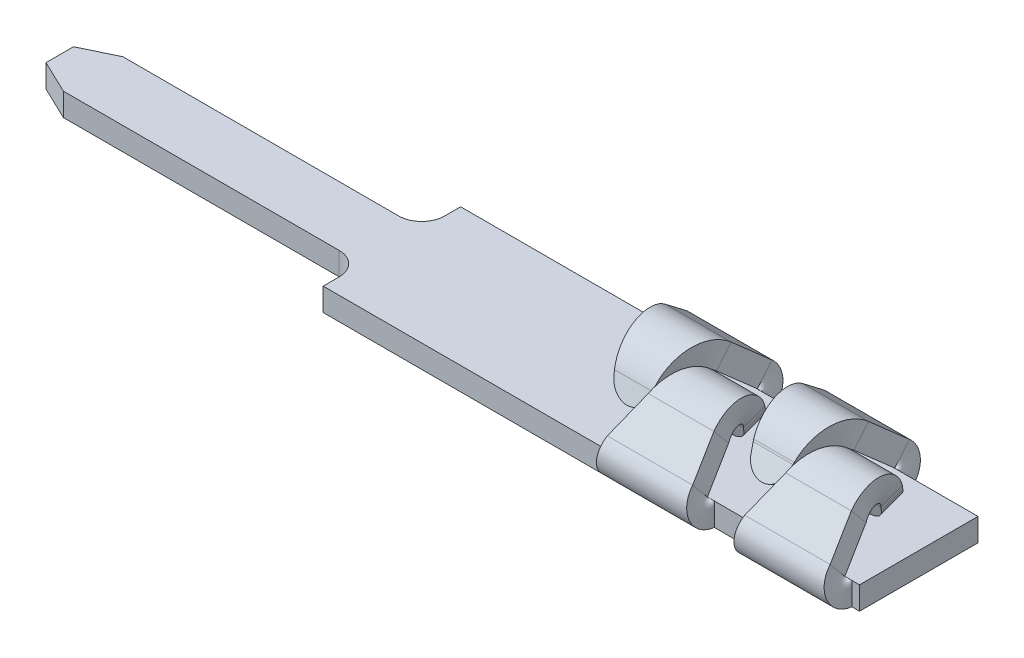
SolidWorks part; units mm, degrees
ref_plane "Front Plane" through (0, 0, 0) normal (0, 0, 1) x (1, 0, 0)
ref_plane "Top Plane" through (0, 0, 0) normal (0, 1, 0) x (1, 0, 0)
ref_plane "Right Plane" through (0, 0, 0) normal (1, 0, 0) x (0, 0, -1)
sketch "Sketch1" plane through (0, 0, 0) normal (0, 1, 0) x (1, 0, 0)
  line L0 (-0.5492, 0.657) -> (-0.5992, 0.657)
  line L1 (-2.921, 0.762) -> (-0.5992, 0.762)
  line L2 (-2.921, 0.762) -> (-2.921, 0.5842)
  line L3 (-2.921, -0.762) -> (0.1628, -0.762)
  line L4 (2.921, 0.657) -> (2.921, -0.657)
  line L5 (-3.175, 0.3302) -> (-6.2338, 0.3302)
  line L6 (-2.921, -0.5842) -> (-2.921, -0.762)
  line L7 (-6.2338, -0.3302) -> (-3.175, -0.3302)
  line L8 (-6.2338, -0.3302) -> (-6.604, -0.1524)
  line L9 (-6.2338, 0.3302) -> (-6.604, 0.1524)
  line L10 (-6.604, 0.1524) -> (-6.604, -0.1524)
  line L11 (0.2128, -0.657) -> (0.5645, -2.1045)
  line L12 (0.9595, -2.1045) -> (1.3112, -0.657)
  line L13 (2.4835, -2.1045) -> (2.8352, -0.657)
  line L14 (1.7368, -0.657) -> (2.0885, -2.1045)
  line L15 (2.8352, -0.657) -> (2.921, -0.657)
  line L16 (1.3112, -0.657) -> (1.7368, -0.657)
  line L17 (2.0732, 0.657) -> (1.7215, 2.1045)
  line L18 (1.3265, 2.1045) -> (0.9748, 0.657)
  line L19 (2.0732, 0.657) -> (2.921, 0.657)
  line L20 (0.5492, 0.657) -> (0.1975, 2.1045)
  line L21 (-0.1975, 2.1045) -> (-0.5492, 0.657)
  line L22 (0.5492, 0.657) -> (0.9748, 0.657)
  line L23 (0.2128, -0.657) -> (0.1628, -0.657)
  line L24 (-0.5992, 0.657) -> (-0.5992, 0.762)
  line L25 (0.1628, -0.657) -> (0.1628, -0.762)
  arc A0 (-2.921, 0.5842) -> (-3.175, 0.3302) centre (-3.175, 0.5842) cw
  arc A1 (-2.921, -0.5842) -> (-3.175, -0.3302) centre (-3.175, -0.5842) ccw
  arc A2 (0.5645, -2.1045) -> (0.9595, -2.1045) centre (0.762, -2.0565) ccw
  arc A3 (2.0885, -2.1045) -> (2.4835, -2.1045) centre (2.286, -2.0565) ccw
  arc A4 (1.7215, 2.1045) -> (1.3265, 2.1045) centre (1.524, 2.0565) ccw
  arc A5 (0.1975, 2.1045) -> (-0.1975, 2.1045) centre (0, 2.0565) ccw
  point P7 (-6.604, 0)
  point P16 (-2.921, -0.3302)
  dimension "D7" = 0.254
  dimension "D9" = 0.2032
  dimension "D1" = 1.524
  dimension "D2" = 5.842
  dimension "D3" = 0.6604
  dimension "D4" = 0.3302
  dimension "D5" = 3.683
  dimension "D6" = 0.3048
  dimension "D8" = 0.635
  dimension "D10" = 103.658
  dimension "D11" = 2.159
  dimension "D12" = 1.3995
  dimension "D13" = 1.3995
  dimension "D14" = 1.397
  dimension "D15" = 2.921
  dimension "D16" = 0.762
  dimension "D17" = 2.921
  dimension "D18" = 0.105
  dimension "D19" = 0.105
  dimension "D20" = 0.05
  dimension "D21" = 0.05
  dimension "D22" = 0.3702
sheet metal parameters "Sheet-Metal1" thickness 0.254 parameters "D1"=0.7366
base flange "Base-Flange1" sketch "Sketch1" thickness 0.254 reverse thickness direction yes parameters "D1"=0.7366
sketch "Sketch4" plane through (0, 0.254, 0) normal (0, 1, 0) x (1, 0, 0)
  line L0 (-0.5771, 0.657) -> (2.5966, 0.657)
  line L1 (-0.5992, 0.762) -> (-2.921, 0.762) construction
  line L2 (0.1943, -0.657) -> (2.8954, -0.657)
  line L4 (-2.921, -0.762) -> (0.1628, -0.762) construction
  line L5 (-0.5992, 0.762) -> (-2.921, 0.762) construction
  dimension "D1" = 0.105
  dimension "D2" = 0.105
sketched bend "Sketched Bend2" parameters "D1"=0.001
bend "SketchBend2" bend radius 0.001 bend angle 140 parameters "D5"=1
bend "SketchBend3" bend radius 0.001 bend angle 140 parameters "D5"=3
sketch "Sketch5" plane through (0, 0.4739, 0.3977) normal (0, -0.766, -0.6428) x (1, 0, 0)
  line L0 (2.8195, -0.11) -> (0.2215, -0.11)
  line L2 (1.3112, 0.34) -> (1.7368, 0.34) construction
  dimension "D1" = 0.45
sketched bend "Sketched Bend3" parameters "D1"=0.2
bend "SketchBend4" bend radius 0.2 bend angle 110 parameters "D5"=4
sketch "Sketch6" plane through (0, 0.4739, -0.3977) normal (0, -0.766, 0.6428) x (1, 0, 0)
  line L0 (0.4593, 0.11) -> (-0.5882, 0.11)
  line L1 (0.9748, -0.34) -> (0.5492, -0.34) construction
  line L2 (2.921, -0.34) -> (2.0732, -0.34) construction
  dimension "D1" = 0.45
sketched bend "Sketched Bend4" parameters "D1"=0.2
bend "SketchBend5" bend radius 0.2 bend angle 110 parameters "D5"=5
sketch "Sketch7" plane through (0, 0.4739, -0.3977) normal (0, -0.766, 0.6428) x (1, 0, 0)
  line L0 (1.0701, 0.11) -> (1.9456, 0.11)
  line L1 (2.921, -0.34) -> (2.0732, -0.34) construction
  dimension "D2" = 0.45
sketched bend "Sketched Bend5" parameters "D1"=0.2
bend "SketchBend6" bend radius 0.2 bend angle 100 parameters "D5"=8
flat pattern "Flat-Pattern1"
sketch "Bend-Lines1" plane through (0, 0.254, 0) normal (0, 1, 0) x (-1, 0, 0)
  line L1 (-1.2293, -1.7045) -> (-1.8187, -1.7045) construction
  line L2 (-0.2877, -1.733) -> (0.2877, -1.733) construction
  line L3 (-2.5737, 1.733) -> (-0.4743, 1.733) construction
  line L4 (-0.2508, 0.8134) -> (-2.7972, 0.8134) construction
  line L5 (0.5112, -0.8134) -> (-2.0352, -0.8134) construction
  line L7 (-1.2293, -1.7045) -> (-1.8187, -1.7045) construction
  line L8 (-0.2877, -1.733) -> (0.2877, -1.733) construction
  line L9 (-1.0497, 1.733) -> (-0.4743, 1.733) construction
  line L10 (-2.5737, 1.733) -> (-1.9983, 1.733) construction
  line L11 (-0.2508, 0.8134) -> (-1.2732, 0.8134) construction
  line L12 (-1.7748, 0.8134) -> (-2.7972, 0.8134) construction
  line L13 (0.5112, -0.8134) -> (-0.5112, -0.8134) construction
  line L14 (-1.0128, -0.8134) -> (-2.0352, -0.8134) construction
  point P0 (3.476, 0.3302)
  point P1 (3.476, -0.3302)
bend of the flat pattern "Flatten-<SketchBend2>1"
bend of the flat pattern "Flatten-<SketchBend3>1"
bend of the flat pattern "Flatten-<SketchBend4>1"
bend of the flat pattern "Flatten-<SketchBend5>1"
bend of the flat pattern "Flatten-<SketchBend6>2"
